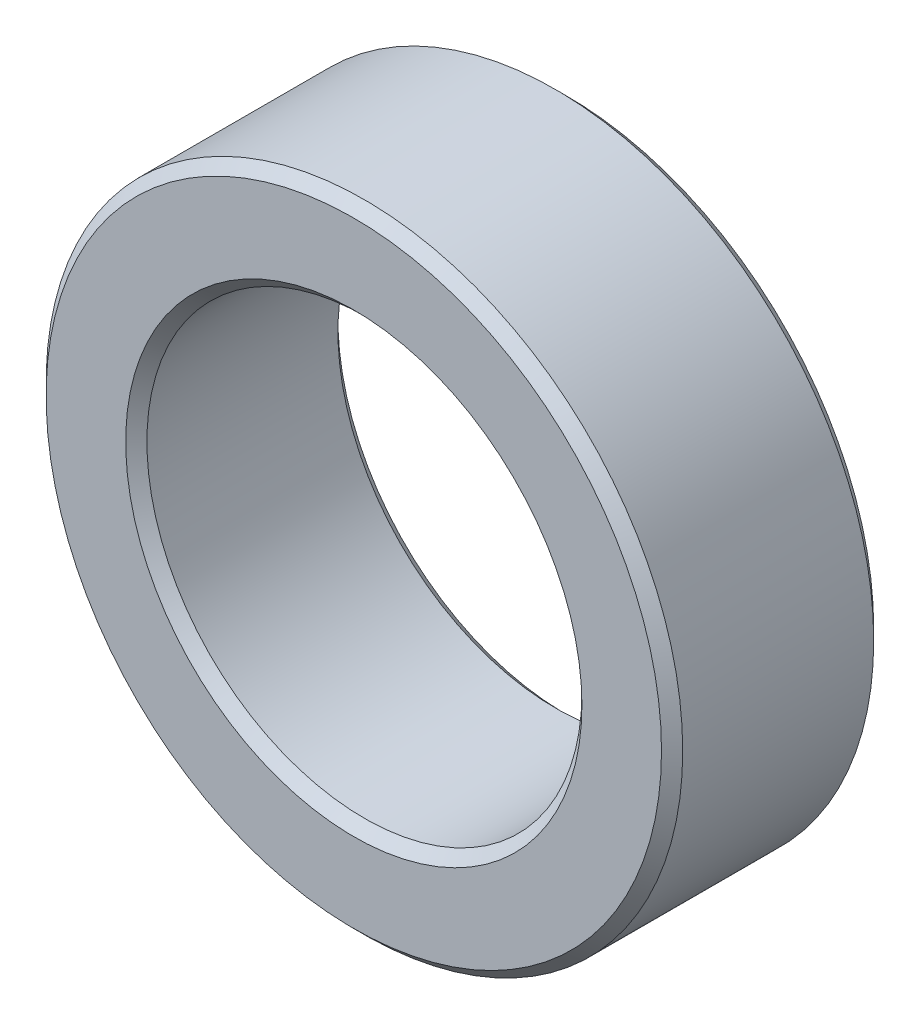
SolidWorks part; units mm, degrees
ref_plane "Front Plane" through (0, 0, 0) normal (0, 0, 1) x (1, 0, 0)
ref_plane "Top Plane" through (0, 0, 0) normal (0, 1, 0) x (1, 0, 0)
ref_plane "Right Plane" through (0, 0, 0) normal (1, 0, 0) x (0, 0, -1)
sketch "Sketch1" plane through (0, 0, 0) normal (0, 0, 1) x (1, 0, 0)
  circle A0 centre (0, 0) radius 6
  circle A1 centre (0, 0) radius 4.1
  dimension "D1" = 12
  dimension "D2" = 8.2
extrude "Boss-Extrude2" add sketch "Sketch1" along normal mid plane 4
chamfer "Chamfer3" distance 0.2 angle 45 4 edges at (6, 0, 2) (6, 0, -2) (4.1, 0, -2) (4.1, 0, 2)
